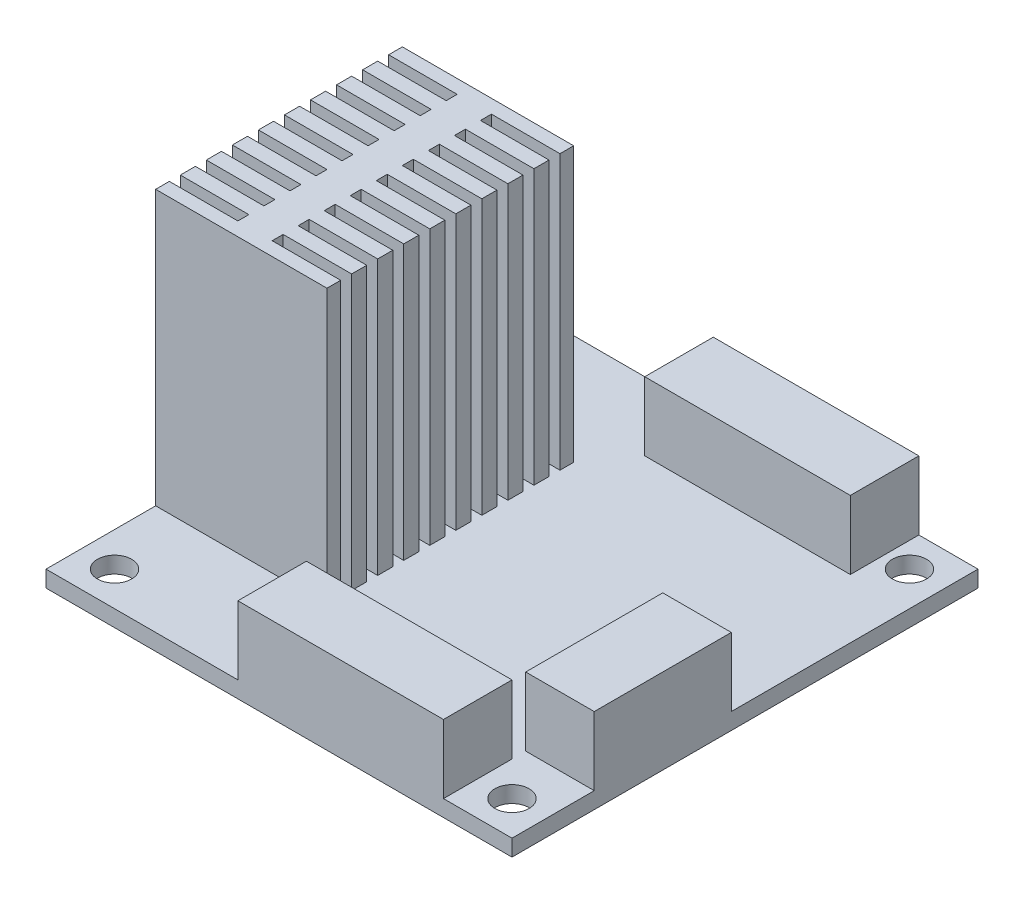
SolidWorks part; units mm, degrees
ref_plane "Front Plane" through (0, 0, 0) normal (0, 0, 1) x (1, 0, 0)
ref_plane "Top Plane" through (0, 0, 0) normal (0, 1, 0) x (1, 0, 0)
ref_plane "Right Plane" through (0, 0, 0) normal (1, 0, 0) x (0, 0, -1)
sketch "Sketch2" plane through (0, 0, 0) normal (0, 1, 0) x (1, 0, 0)
  line L1 (0, 0) -> (43.18, 0)
  line L2 (0, 0) -> (0, 43.18)
  line L3 (0, 43.18) -> (43.18, 43.18)
  line L4 (43.18, 0) -> (43.18, 43.18)
  dimension "D1" = 43.18
  dimension "D2" = 43.18
extrude "Boss-Extrude1" add sketch "Sketch2" along normal blind 1.524
sketch "Sketch3" plane through (0, 1.524, 0) normal (0, 1, 0) x (1, 0, 0)
  line L0 (0, 43.18) -> (0, 0) construction
  line L1 (0, 10.16) -> (15.875, 10.16)
  line L2 (0, 10.16) -> (0, 11.43)
  line L3 (0, 33.02) -> (15.875, 33.02)
  line L4 (15.875, 10.16) -> (15.875, 11.43)
  line L5 (43.18, 43.18) -> (0, 43.18) construction
  line L7 (0, 31.75) -> (6.35, 31.75)
  line L9 (0, 30.734) -> (6.35, 30.734)
  line L10 (6.35, 31.75) -> (6.35, 30.734)
  line L11 (0, 29.337) -> (6.35, 29.337)
  line L12 (6.35, 29.337) -> (6.35, 28.321)
  line L13 (0, 28.321) -> (6.35, 28.321)
  line L15 (0, 26.924) -> (6.35, 26.924)
  line L16 (6.35, 26.924) -> (6.35, 25.908)
  line L17 (0, 25.908) -> (6.35, 25.908)
  line L19 (0, 24.511) -> (6.35, 24.511)
  line L20 (6.35, 24.511) -> (6.35, 23.495)
  line L21 (0, 23.495) -> (6.35, 23.495)
  line L23 (0, 22.098) -> (6.35, 22.098)
  line L24 (6.35, 22.098) -> (6.35, 21.082)
  line L25 (0, 21.082) -> (6.35, 21.082)
  line L27 (0, 19.685) -> (6.35, 19.685)
  line L28 (6.35, 19.685) -> (6.35, 18.669)
  line L29 (0, 18.669) -> (6.35, 18.669)
  line L31 (0, 17.272) -> (6.35, 17.272)
  line L32 (6.35, 17.272) -> (6.35, 16.256)
  line L33 (0, 16.256) -> (6.35, 16.256)
  line L35 (0, 14.859) -> (6.35, 14.859)
  line L36 (6.35, 14.859) -> (6.35, 13.843)
  line L37 (0, 13.843) -> (6.35, 13.843)
  line L39 (0, 12.446) -> (6.35, 12.446)
  line L40 (6.35, 12.446) -> (6.35, 11.43)
  line L41 (0, 11.43) -> (6.35, 11.43)
  line L43 (15.875, 31.75) -> (9.525, 31.75)
  line L45 (15.875, 30.734) -> (9.525, 30.734)
  line L46 (9.525, 31.75) -> (9.525, 30.734)
  line L47 (15.875, 29.337) -> (9.525, 29.337)
  line L48 (9.525, 29.337) -> (9.525, 28.321)
  line L49 (15.875, 28.321) -> (9.525, 28.321)
  line L51 (15.875, 26.924) -> (9.525, 26.924)
  line L52 (9.525, 26.924) -> (9.525, 25.908)
  line L53 (15.875, 25.908) -> (9.525, 25.908)
  line L55 (15.875, 24.511) -> (9.525, 24.511)
  line L56 (9.525, 24.511) -> (9.525, 23.495)
  line L57 (15.875, 23.495) -> (9.525, 23.495)
  line L59 (15.875, 22.098) -> (9.525, 22.098)
  line L60 (9.525, 22.098) -> (9.525, 21.082)
  line L61 (15.875, 21.082) -> (9.525, 21.082)
  line L63 (15.875, 19.685) -> (9.525, 19.685)
  line L64 (9.525, 19.685) -> (9.525, 18.669)
  line L65 (15.875, 18.669) -> (9.525, 18.669)
  line L67 (15.875, 17.272) -> (9.525, 17.272)
  line L68 (9.525, 17.272) -> (9.525, 16.256)
  line L69 (15.875, 16.256) -> (9.525, 16.256)
  line L71 (15.875, 14.859) -> (9.525, 14.859)
  line L72 (9.525, 14.859) -> (9.525, 13.843)
  line L73 (15.875, 13.843) -> (9.525, 13.843)
  line L75 (15.875, 12.446) -> (9.525, 12.446)
  line L76 (9.525, 12.446) -> (9.525, 11.43)
  line L77 (15.875, 11.43) -> (9.525, 11.43)
  line L78 (15.875, 31.75) -> (15.875, 33.02)
  line L79 (15.875, 29.337) -> (15.875, 30.734)
  line L80 (15.875, 26.924) -> (15.875, 28.321)
  line L81 (15.875, 24.511) -> (15.875, 25.908)
  line L82 (15.875, 22.098) -> (15.875, 23.495)
  line L83 (15.875, 19.685) -> (15.875, 21.082)
  line L84 (15.875, 17.272) -> (15.875, 18.669)
  line L85 (15.875, 14.859) -> (15.875, 16.256)
  line L86 (15.875, 12.446) -> (15.875, 13.843)
  line L87 (0, 12.446) -> (0, 13.843)
  line L89 (0, 14.859) -> (0, 16.256)
  line L91 (0, 17.272) -> (0, 18.669)
  line L93 (0, 19.685) -> (0, 21.082)
  line L95 (0, 22.098) -> (0, 23.495)
  line L97 (0, 24.511) -> (0, 25.908)
  line L99 (0, 26.924) -> (0, 28.321)
  line L101 (0, 29.337) -> (0, 30.734)
  line L103 (0, 31.75) -> (0, 33.02)
  dimension "D1" = 22.86
  dimension "D2" = 15.875
  dimension "D3" = 10.16
  dimension "D4" = 1.27
  dimension "D5" = 1.016
  dimension "D6" = 6.35
  dimension "D8" = 6.35
  dimension "D9" = 1.016
  dimension "D10" = 1.27
  dimension "D7" = 9
  dimension "D11" = 9
extrude "Boss-Extrude2" add sketch "Sketch3" along normal blind 25.4
sketch "Sketch4" plane through (0, 1.524, 0) normal (0, 1, 0) x (1, 0, 0)
  line L0 (0, 0) -> (43.18, 0) construction
  line L1 (17.78, 0) -> (36.83, 0)
  line L2 (17.78, 0) -> (17.78, 6.35)
  line L3 (17.78, 6.35) -> (36.83, 6.35)
  line L4 (36.83, 0) -> (36.83, 6.35)
  line L5 (43.18, 43.18) -> (0, 43.18) construction
  line L6 (18.6504, 43.18) -> (37.7004, 43.18)
  line L7 (18.6504, 43.18) -> (18.6504, 36.83)
  line L8 (18.6504, 36.83) -> (37.7004, 36.83)
  line L9 (37.7004, 43.18) -> (37.7004, 36.83)
  line L10 (43.18, 0) -> (43.18, 43.18) construction
  line L12 (43.18, 15.875) -> (43.18, 6.35)
  line L16 (43.18, 7.62) -> (36.83, 7.62)
  line L17 (43.18, 7.62) -> (43.18, 20.32)
  line L18 (43.18, 20.32) -> (36.83, 20.32)
  line L19 (36.83, 7.62) -> (36.83, 20.32)
  dimension "D1" = 19.05
  dimension "D2" = 19.05
  dimension "D3" = 6.35
  dimension "D4" = 6.35
  dimension "D5" = 7.62
  dimension "D6" = 6.35
  dimension "D7" = 12.7
extrude "Boss-Extrude4" add sketch "Sketch4" along normal blind 6.35 contours L2 L1 L4 L3 | L17 L16 L19 L18 | L7 L6 L9 L8
sketch "Sketch5" plane through (0, 1.524, 0) normal (0, 1, 0) x (1, 0, 0)
  line L0 (18.6504, 43.18) -> (0, 43.18) construction
  line L1 (0, 43.18) -> (0, 33.02) construction
  line L2 (43.18, 20.32) -> (43.18, 43.18) construction
  line L3 (43.18, 43.18) -> (37.7004, 43.18) construction
  line L4 (43.18, 0) -> (43.18, 7.62) construction
  line L5 (36.83, 0) -> (43.18, 0) construction
  line L6 (0, 0) -> (17.78, 0) construction
  line L7 (0, 10.16) -> (0, 0) construction
  circle A0 centre (3.175, 40.005) radius 1.5875
  circle A1 centre (40.005, 40.005) radius 1.5875
  circle A2 centre (40.005, 3.175) radius 1.5875
  circle A3 centre (3.175, 3.175) radius 1.5875
  dimension "D1" = 3.175
  dimension "D2" = 3.175
  dimension "D3" = 3.175
  dimension "D4" = 3.175
  dimension "D5" = 3.175
  dimension "D6" = 3.175
  dimension "D7" = 3.175
  dimension "D8" = 3.175
  dimension "D9" = 3.175
  dimension "D10" = 3.175
  dimension "D11" = 3.175
  dimension "D12" = 3.175
extrude "Cut-Extrude1" cut sketch "Sketch5" against normal blind 6.35
